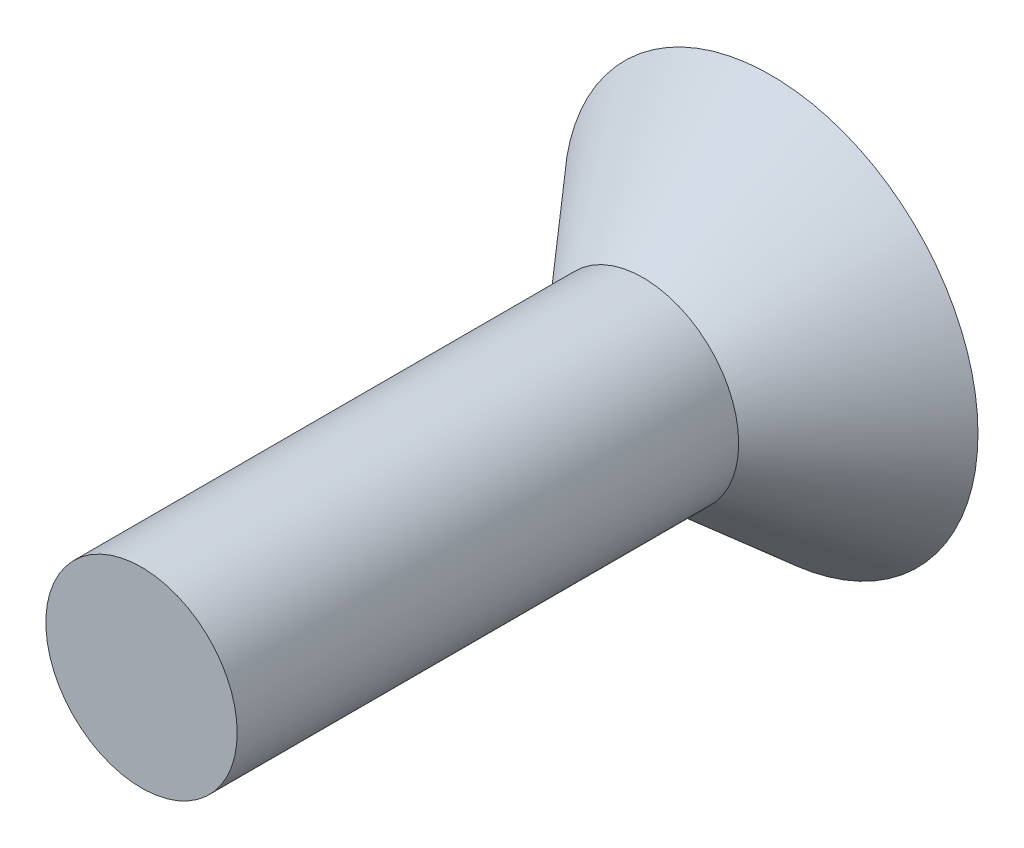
SolidWorks part; units mm, degrees
ref_plane "Front Plane" through (0, 0, 0) normal (0, 0, 1) x (1, 0, 0)
ref_plane "Top Plane" through (0, 0, 0) normal (0, 1, 0) x (1, 0, 0)
ref_plane "Right Plane" through (0, 0, 0) normal (1, 0, 0) x (0, 0, -1)
sketch "Sketch6" plane through (0, 0, 0) normal (1, 0, 0) x (0, 0, -1)
  line L0 (-15.875, 0) -> (22.525, 0) construction
  line L1 (5.7417, 0) -> (-5.7417, 0) construction
  line L2 (-15.875, 0) -> (-15.875, -2.413)
  line L3 (-15.875, -2.413) -> (-3.2287, -2.413)
  line L6 (-3.2287, -2.413) -> (0, -5.2197)
  line L7 (0, -5.2197) -> (0, 0)
  line L8 (0, 0) -> (-15.875, 0)
  dimension "D1" = 41
  dimension "L" = 15.875
  dimension "A" = 10.4394
  dimension "D" = 4.826
revolve "Revolve1" add sketch "Sketch6" angle 360 about L0
sketch "Sketch7" plane through (0, 0, 0) normal (0, 0, -1) x (-1, 0, 0)
  line L2 (-1.5875, 0.9165) -> (-1.5875, -0.9165)
  line L4 (-1.5875, -0.9165) -> (0, -1.8331)
  line L5 (0, -1.8331) -> (1.5875, -0.9165)
  line L6 (1.5875, -0.9165) -> (1.5875, 0.9165)
  line L7 (1.5875, 0.9165) -> (0, 1.8331)
  line L8 (0, 1.8331) -> (-1.5875, 0.9165)
  circle A0 centre (0, 0) radius 1.5875 construction
  dimension "J" = 3.175
extrude "HEX" cut sketch "Sketch7" against normal blind 3.048
